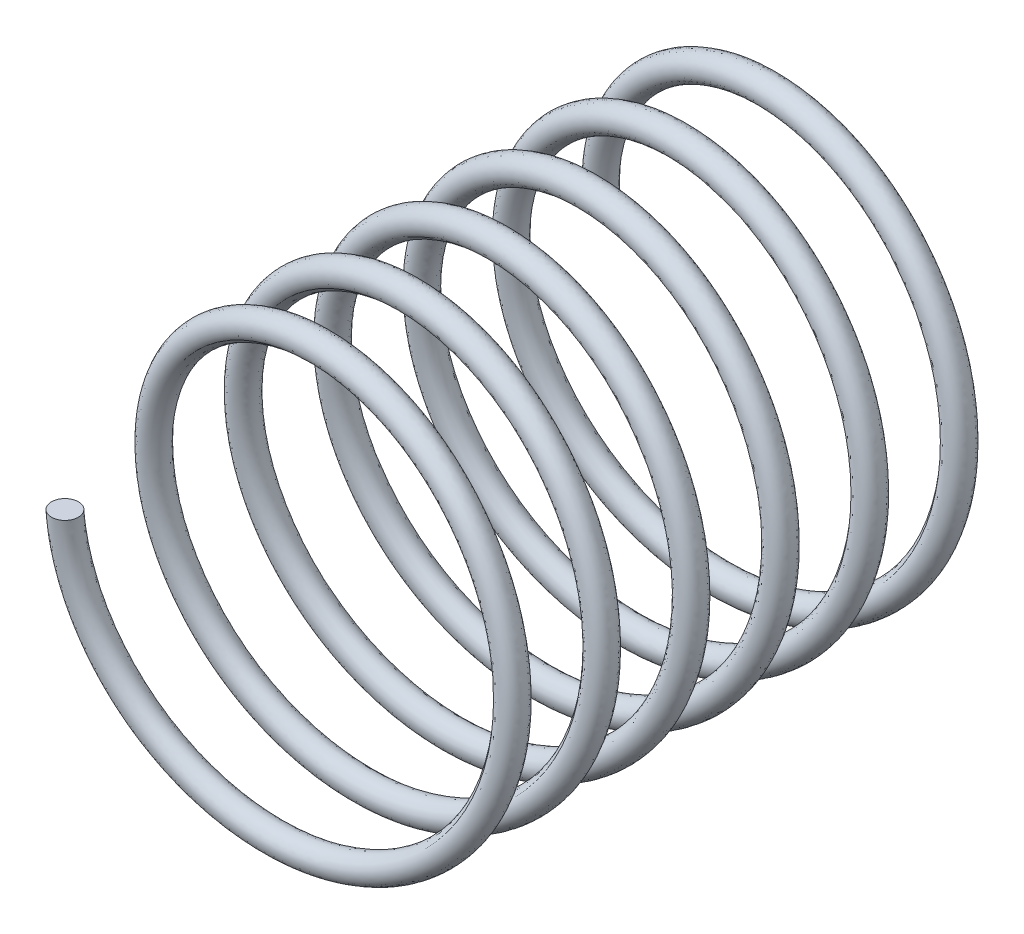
SolidWorks part; units mm, degrees
ref_plane "Front Plane" through (0, 0, 0) normal (0, 0, 1) x (1, 0, 0)
ref_plane "Top Plane" through (0, 0, 0) normal (0, 1, 0) x (1, 0, 0)
ref_plane "Right Plane" through (0, 0, 0) normal (1, 0, 0) x (0, 0, -1)
sketch "Sketch1" plane through (0, 0, 0) normal (0, 0, 1) x (1, 0, 0)
  circle A0 centre (0, 0) radius 4.5
  dimension "D1" = 9
curve "Helix/Spiral1"
ref_plane "Plane1" through (0, 0, 0) normal (0, 1, 0) x (1, 0, 0)
sketch "Sketch2" plane through (0, 0, 0) normal (0, 1, 0) x (1, 0, 0)
  circle A0 centre (-4.5, -12) radius 0.3
  spline S0 degree 3 number of poles 99 (-4.5, 0) -> (-4.5, -12) construction
  dimension "D1" = 0.6
sweep "Sweep1" add profiles "Sketch2" path "Helix/Spiral1"
